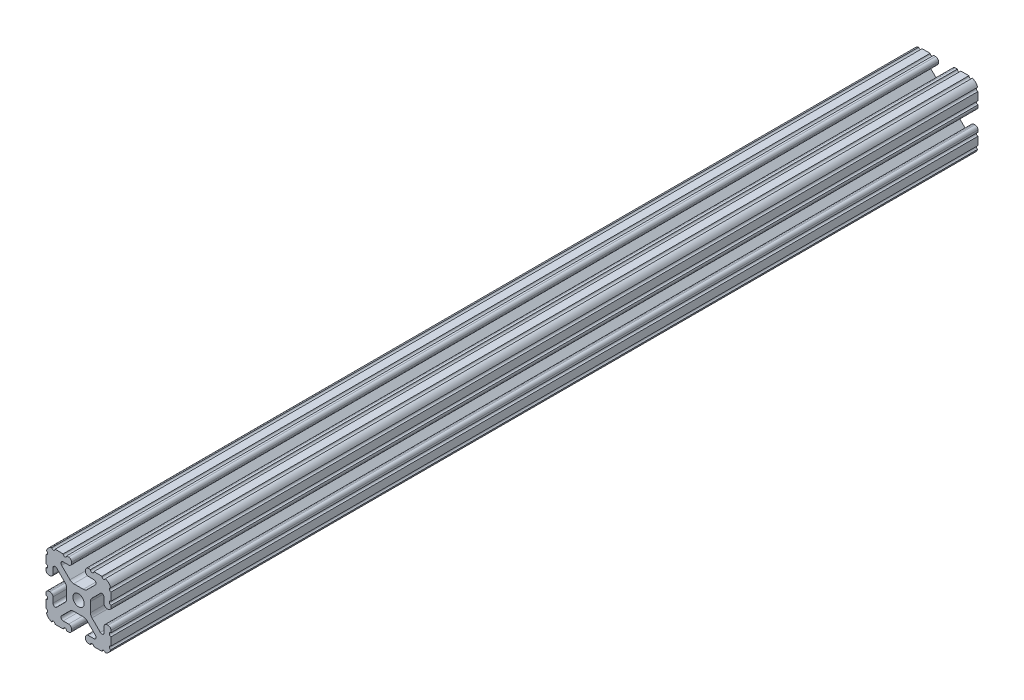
SolidWorks part; units mm, degrees
ref_plane "Front Plane" through (0, 0, 0) normal (0, 0, 1) x (1, 0, 0)
ref_plane "Top Plane" through (0, 0, 0) normal (0, 1, 0) x (1, 0, 0)
ref_plane "Right Plane" through (0, 0, 0) normal (1, 0, 0) x (0, 0, -1)
sketch "Sketch2" plane through (0, 0, 0) normal (0, 0, 1) x (1, 0, 0)
  line L0 (0, 19.05) -> (0, -19.05) construction
  line L1 (-19.05, 0) -> (19.05, 0) construction
  line L2 (4.064, -19.05) -> (19.05, -19.05)
  line L3 (19.05, -19.05) -> (19.05, -4.064)
  line L4 (4.064, -19.05) -> (4.064, -14.986)
  line L5 (4.064, -14.986) -> (12.1123, -14.986)
  line L6 (12.1123, -14.986) -> (4.1113, -6.985)
  line L7 (0, 0) -> (19.05, -19.05) construction
  line L8 (19.05, -4.064) -> (14.986, -4.064)
  line L9 (14.986, -4.064) -> (14.986, -12.1123)
  line L10 (14.986, -12.1123) -> (6.985, -4.1113)
  circle A0 centre (0, 0) radius 3.3274
  arc A1 (8.9963, -14.986) -> (9.909, -12.7826) centre (8.9963, -13.6953) ccw construction
  point P8 (0, -6.985)
sketch "Sketch3" plane through (0, 0, 0) normal (1, 0, 0) x (0, 0, -1)
  line L0 (-457.2, -19.05) -> (457.2, -19.05) construction
  line L1 (-431.8, 0) -> (431.8, 0) construction
sketch "Sketch4" plane through (0, 0, 0) normal (0, 0, 1) x (1, 0, 0)
  line L0 (5.7912, -19.05) -> (14.3002, -19.05)
  line L1 (4.064, -19.05) -> (19.05, -19.05) construction
  line L2 (4.064, -19.05) -> (4.064, -14.986) construction
  line L3 (4.064, -14.986) -> (12.1123, -14.986) construction
  line L4 (4.064, -16.7132) -> (4.064, -17.3228)
  line L5 (5.7912, -14.986) -> (8.9963, -14.986)
  line L6 (0, -6.985) -> (2.833, -6.985)
  line L7 (12.1123, -14.986) -> (4.1113, -6.985) construction
  line L8 (5.0152, -7.8889) -> (9.909, -12.7826)
  line L9 (19.05, -19.05) -> (19.05, -4.064) construction
  line L10 (14.986, -12.1123) -> (6.985, -4.1113) construction
  line L11 (14.986, -4.064) -> (14.986, -12.1123) construction
  line L12 (14.986, -8.9963) -> (14.986, -5.7912)
  line L13 (19.05, -4.064) -> (14.986, -4.064) construction
  line L14 (16.7132, -4.064) -> (17.3228, -4.064)
  line L15 (19.05, -5.7912) -> (19.05, -14.3002)
  line L16 (12.7826, -9.909) -> (7.8889, -5.0152)
  line L17 (6.985, 0) -> (6.985, -2.833)
  line L18 (-19.05, 0) -> (19.05, 0) construction
  line L19 (0, -6.985) -> (0, -3.3274)
  line L20 (0, 19.05) -> (0, -19.05) construction
  line L21 (6.985, 0) -> (3.3274, 0)
  arc A0 (4.064, -17.3228) -> (5.7912, -19.05) centre (5.7912, -17.3228) ccw
  arc A2 (4.064, -16.7132) -> (5.7912, -14.986) centre (5.7912, -16.7132) cw
  arc A3 (8.9963, -14.986) -> (9.909, -12.7826) centre (8.9963, -13.6953) ccw
  arc A4 (2.833, -6.985) -> (5.0152, -7.8889) centre (2.833, -10.0711) cw
  arc A5 (14.3002, -19.05) -> (19.05, -14.3002) centre (14.3002, -14.3002) ccw
  arc A6 (12.7826, -9.909) -> (14.986, -8.9963) centre (13.6953, -8.9963) ccw
  arc A7 (14.986, -5.7912) -> (16.7132, -4.064) centre (16.7132, -5.7912) cw
  arc A8 (17.3228, -4.064) -> (19.05, -5.7912) centre (17.3228, -5.7912) cw
  arc A9 (7.8889, -5.0152) -> (6.985, -2.833) centre (10.0711, -2.833) cw
  circle A10 centre (0, 0) radius 3.3274 construction
  arc A11 (0, -3.3274) -> (3.3274, 0) centre (0, 0) ccw
extrude "Boss-Extrude1" add sketch "Sketch4" along normal mid plane 914.4
sketch "Sketch5" plane through (0, 0, 0) normal (0, 0, 1) x (1, 0, 0)
  line L0 (4.064, -19.05) -> (19.05, -19.05) construction
  line L1 (5.7912, -14.986) -> (8.9963, -14.986) construction
  line L3 (0, 0) -> (19.05, -19.05) construction
  line L4 (8.9963, -14.986) -> (8.9963, -19.05) construction
  line L5 (12.1123, -14.986) -> (4.1113, -6.985) construction
  circle A0 centre (14.7395, -19.05) radius 1.016
  circle A1 centre (7.9803, -19.05) radius 1.016
  circle A2 centre (19.05, -14.7395) radius 1.016
  circle A3 centre (19.05, -7.9803) radius 1.016
  point P10 (7.3938, -14.986)
  point P12 (13.6953, -8.9963)
extrude "Cut-Extrude1" cut sketch "Sketch5" against normal through all both and the other way through all
mirror "Mirror1" about plane through (0, 0, 0) normal (1, 0, 0)
mirror "Mirror2" about plane through (0, 0, 0) normal (0, 1, 0)
sketch "Sketch6" plane through (0, 0, 457.2) normal (0, 0, 1) x (1, 0, 0)
  line L1 (19.5673, -19.4887) -> (-19.5673, -19.4887)
  line L2 (19.5673, -19.4887) -> (19.5673, 19.4887)
  line L3 (19.5673, 19.4887) -> (-19.5673, 19.4887)
  line L4 (-19.5673, -19.4887) -> (-19.5673, 19.4887)
  line L5 (19.5673, -19.4887) -> (-19.5673, 19.4887) construction
  line L6 (19.5673, 19.4887) -> (-19.5673, -19.4887) construction
  point P0 (0, 0)
extrude "Cut-Extrude2" cut sketch "Sketch6" against normal offset from surface (406.4 mm away) 508
equation "\"D1@Boss-Extrude1\"=\"Length@Sketch3\""
equation "\"D1@Sketch2\"=\"Thickness@Sketch2\""
equation "\"D2@Sketch4\"=\"Slot Inner Width@Sketch2\"*0.15"
equation "\"D1@Sketch4\"=\"D3@Sketch4\"*2.75"
equation "\"D3@Sketch4\"=\"Thickness@Sketch2\"*0.425"
equation "\"D1@Sketch5\"=\"Thickness@Sketch2\"*0.5"
